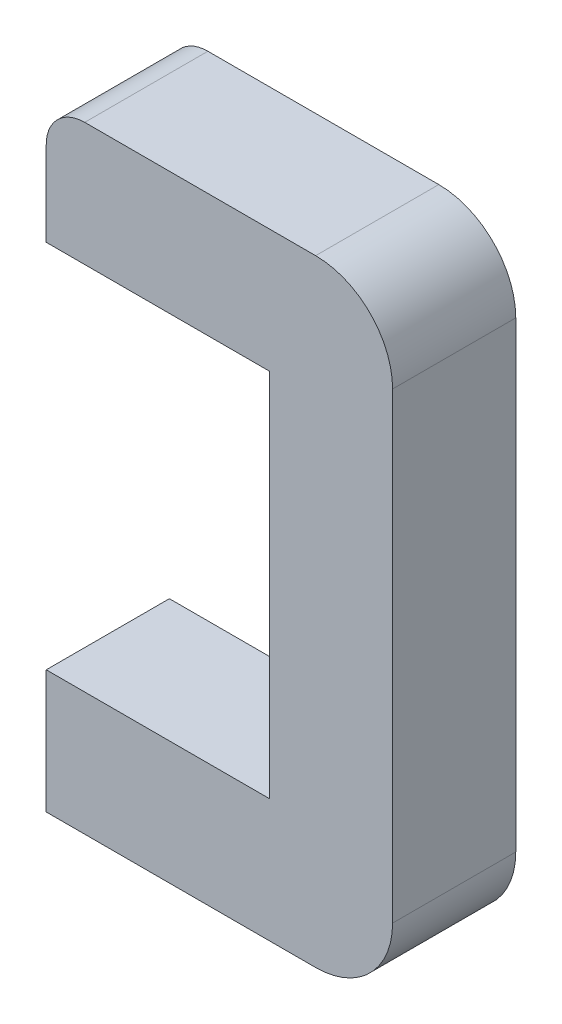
SolidWorks part; units mm, degrees
ref_plane "Front Plane" through (0, 0, 0) normal (0, 0, 1) x (1, 0, 0)
ref_plane "Top Plane" through (0, 0, 0) normal (0, 1, 0) x (1, 0, 0)
ref_plane "Right Plane" through (0, 0, 0) normal (1, 0, 0) x (0, 0, -1)
sketch "Sketch1" plane through (0, 0, 0) normal (0, 0, 1) x (1, 0, 0)
  line L0 (1.485, 31.1973) -> (1.485, 15.1973)
  line L2 (1.485, 15.1973) -> (30.485, 15.1973)
  line L3 (1.485, -32.8967) -> (30.485, -32.8967)
  line L4 (30.485, 15.1973) -> (30.485, -32.8967)
  line L6 (1.485, -32.8967) -> (1.485, -48.8967)
  line L7 (1.485, 31.1973) -> (46.485, 31.1973)
  line L9 (1.485, -48.8967) -> (46.485, -48.8967)
  line L10 (46.485, 31.1973) -> (46.485, -48.8967)
  point P0 (0, 0)
  point P3 (15.985, 15.1973)
  point P5 (0, 0)
  point P13 (30.485, -8.8497)
  point P14 (46.485, -8.8497)
  point P16 (15.985, -32.8967)
  dimension "D1" = 45
  dimension "D2" = 16
  dimension "D3" = 45
  dimension "D4" = 16
  dimension "D5" = 16
  dimension "D6" = 48.094
extrude "Boss-Extrude1" add sketch "Sketch1" along normal blind 16
fillet "Fillet2" radius 10 2 edges at (46.485, -48.8967, 8) (46.485, 31.1973, 8)
fillet "Fillet3" radius 5 1 edges at (1.485, 31.1973, 8)
fillet "Fillet4" radius 0.01 1 edges at (1.485, -48.8967, 8)
equation "\"thicnes\"= 16mm"
equation "\"D1@Boss-Extrude1\"=\"thicnes\""
